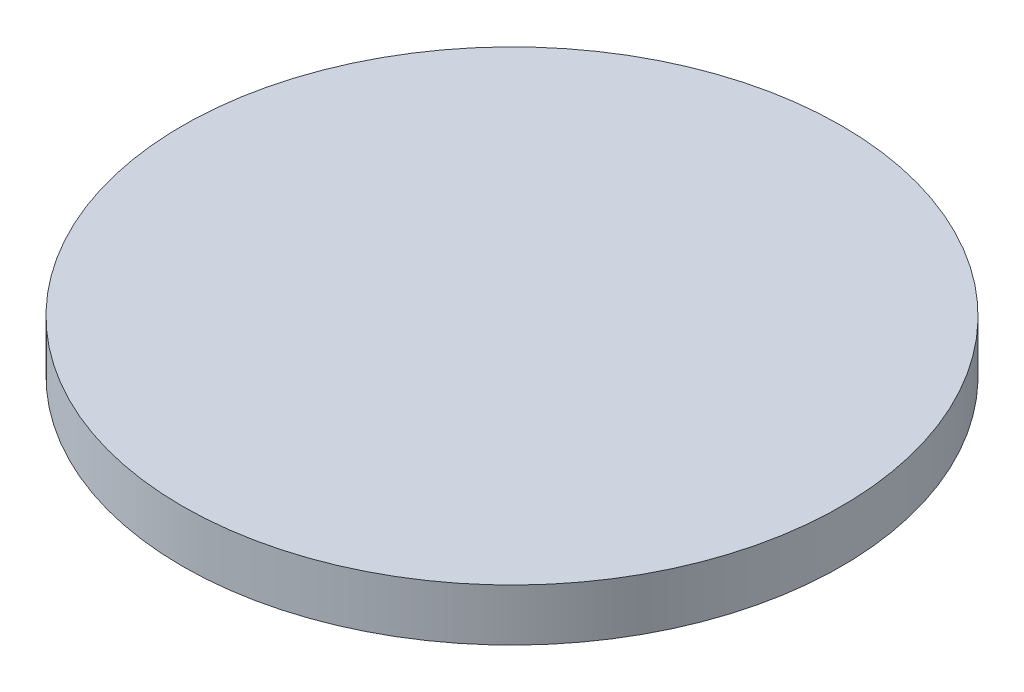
SolidWorks part; units mm, degrees
ref_plane "前视基准面" through (0, 0, 0) normal (0, 0, 1) x (1, 0, 0)
ref_plane "上视基准面" through (0, 0, 0) normal (0, 1, 0) x (1, 0, 0)
ref_plane "右视基准面" through (0, 0, 0) normal (1, 0, 0) x (0, 0, -1)
other "Configuration Table"
sketch "草图1" plane through (0, 0, 0) normal (0, 1, 0) x (1, 0, 0)
  circle A0 centre (0, 0) radius 19
extrude "凸台-拉伸1" add sketch "草图1" along normal blind 3 contours A0
